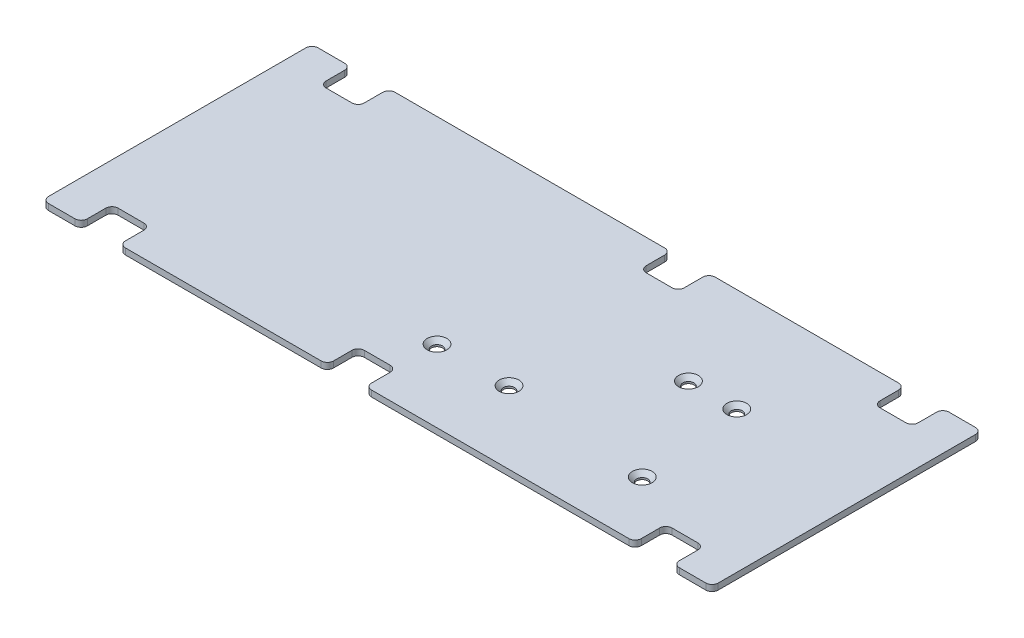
SolidWorks part; units mm, degrees
ref_plane "前视基准面" through (0, 0, 0) normal (0, 0, 1) x (1, 0, 0)
ref_plane "上视基准面" through (0, 0, 0) normal (0, 1, 0) x (1, 0, 0)
ref_plane "右视基准面" through (0, 0, 0) normal (1, 0, 0) x (0, 0, -1)
other "Configuration Table"
sketch "草图1" plane through (0, 0, 0) normal (0, 1, 0) x (1, 0, 0)
  line L1 (252.8066, 0.6) -> (211.0066, 0.6)
  line L2 (210.0066, 1.6) -> (210.0066, 4.6)
  line L3 (209.0066, 5.6) -> (204.8066, 5.6)
  line L4 (203.8066, 4.6) -> (203.8066, 1.6)
  line L5 (202.8066, 0.6) -> (171.0066, 0.6)
  line L6 (170.0066, 1.6) -> (170.0066, 4.6)
  line L7 (169.0066, 5.6) -> (164.8066, 5.6)
  line L8 (163.8066, 4.6) -> (163.8066, 1.6)
  line L9 (162.8066, 0.6) -> (158.5066, 0.6)
  line L10 (157.5066, 1.6) -> (157.5066, 43.4)
  line L11 (158.5066, 44.4) -> (162.8066, 44.4)
  line L12 (163.8066, 43.4) -> (163.8066, 40.4)
  line L13 (164.8066, 39.4) -> (169.0066, 39.4)
  line L14 (170.0066, 40.4) -> (170.0066, 43.4)
  line L15 (171.0066, 44.4) -> (214.8066, 44.4)
  line L16 (215.8066, 43.4) -> (215.8066, 40.4)
  line L17 (216.8066, 39.4) -> (221.0066, 39.4)
  line L18 (222.0066, 40.4) -> (222.0066, 43.4)
  line L19 (223.0066, 44.4) -> (252.8066, 44.4)
  line L20 (253.8066, 43.4) -> (253.8066, 40.4)
  line L21 (254.8066, 39.4) -> (259.0066, 39.4)
  line L22 (260.0066, 40.4) -> (260.0066, 43.4)
  line L23 (261.0066, 44.4) -> (265.3066, 44.4)
  line L24 (266.3066, 43.4) -> (266.3066, 1.6)
  line L25 (265.3066, 0.6) -> (261.0066, 0.6)
  line L26 (260.0066, 1.6) -> (260.0066, 4.6)
  line L27 (259.0066, 5.6) -> (254.8066, 5.6)
  line L28 (253.8066, 4.6) -> (253.8066, 1.6)
  arc A0 (210.0066, 1.6) -> (211.0066, 0.6) centre (211.0066, 1.6) ccw
  arc A1 (210.0066, 4.6) -> (209.0066, 5.6) centre (209.0066, 4.6) ccw
  arc A2 (204.8066, 5.6) -> (203.8066, 4.6) centre (204.8066, 4.6) ccw
  arc A3 (202.8066, 0.6) -> (203.8066, 1.6) centre (202.8066, 1.6) ccw
  arc A4 (170.0066, 1.6) -> (171.0066, 0.6) centre (171.0066, 1.6) ccw
  arc A5 (170.0066, 4.6) -> (169.0066, 5.6) centre (169.0066, 4.6) ccw
  arc A6 (164.8066, 5.6) -> (163.8066, 4.6) centre (164.8066, 4.6) ccw
  arc A7 (162.8066, 0.6) -> (163.8066, 1.6) centre (162.8066, 1.6) ccw
  arc A8 (157.5066, 1.6) -> (158.5066, 0.6) centre (158.5066, 1.6) ccw
  arc A9 (158.5066, 44.4) -> (157.5066, 43.4) centre (158.5066, 43.4) ccw
  arc A10 (163.8066, 43.4) -> (162.8066, 44.4) centre (162.8066, 43.4) ccw
  arc A11 (163.8066, 40.4) -> (164.8066, 39.4) centre (164.8066, 40.4) ccw
  arc A12 (169.0066, 39.4) -> (170.0066, 40.4) centre (169.0066, 40.4) ccw
  arc A13 (171.0066, 44.4) -> (170.0066, 43.4) centre (171.0066, 43.4) ccw
  arc A14 (215.8066, 43.4) -> (214.8066, 44.4) centre (214.8066, 43.4) ccw
  arc A15 (215.8066, 40.4) -> (216.8066, 39.4) centre (216.8066, 40.4) ccw
  arc A16 (221.0066, 39.4) -> (222.0066, 40.4) centre (221.0066, 40.4) ccw
  arc A17 (223.0066, 44.4) -> (222.0066, 43.4) centre (223.0066, 43.4) ccw
  arc A18 (253.8066, 43.4) -> (252.8066, 44.4) centre (252.8066, 43.4) ccw
  arc A19 (253.8066, 40.4) -> (254.8066, 39.4) centre (254.8066, 40.4) ccw
  arc A20 (259.0066, 39.4) -> (260.0066, 40.4) centre (259.0066, 40.4) ccw
  arc A21 (261.0066, 44.4) -> (260.0066, 43.4) centre (261.0066, 43.4) ccw
  arc A22 (266.3066, 43.4) -> (265.3066, 44.4) centre (265.3066, 43.4) ccw
  arc A23 (265.3066, 0.6) -> (266.3066, 1.6) centre (265.3066, 1.6) ccw
  arc A24 (260.0066, 1.6) -> (261.0066, 0.6) centre (261.0066, 1.6) ccw
  arc A25 (260.0066, 4.6) -> (259.0066, 5.6) centre (259.0066, 4.6) ccw
  arc A26 (254.8066, 5.6) -> (253.8066, 4.6) centre (254.8066, 4.6) ccw
  arc A27 (252.8066, 0.6) -> (253.8066, 1.6) centre (252.8066, 1.6) ccw
extrude "凸台-拉伸1" add sketch "草图1" along normal blind 1
sketch "草图3" plane through (0, 1, 0) normal (0, 1, 0) x (1, 0, 0)
  line L0 (164.4066, 45) -> (156.9066, 45)
  line L1 (156.9066, 45) -> (156.9066, 0)
  line L2 (156.9066, 0) -> (164.4066, 0)
  point P3 (209.8499, 12.375)
  point P4 (221.5499, 12.375)
  point P5 (245.2249, 10.3372)
  point P6 (243.3249, 27.6)
  point P7 (235.4749, 27.6)
sketch "草图4" plane through (0, 1, 0) normal (0, 1, 0) x (1, 0, 0)
  point P0 (209.8499, 12.375)
  point P3 (221.5499, 12.375)
  point P6 (235.4749, 27.6)
  point P9 (243.3249, 27.6)
  point P12 (245.2249, 10.3372)
hole_wizard "M1.6 锥坑平头螺钉的锥形沉头孔1" positions "草图4" profile "草图5" countersink size "M1.6" standard "ISO"
sketch "草图5" plane through (209.8499, 1, -12.375) normal (1, 0, 0) x (0, 0, 1)
  line L0 (0, 0) -> (0, 4.7908)
  line L1 (0, 4.7908) -> (0.9, 4.25)
  line L2 (0.9, 4.25) -> (0.9, 0.7)
  line L3 (0.9, 0.7) -> (1.6, 0)
  line L5 (1.6, 0) -> (0, 0)
  line L6 (-0.9, 0.7) -> (-1.6, 0) construction
  line L10 (0, 4.7908) -> (-0.9, 4.25) construction
  line L11 (0, -6.35) -> (0, 107.95) construction
  dimension "孔直径" = 1.8
  dimension "孔深度" = 4.25
  dimension "近端锥形沉头孔直径" = 3.2
  dimension "近端锥形沉头孔角度" = 90
  dimension "导头角度" = 118
